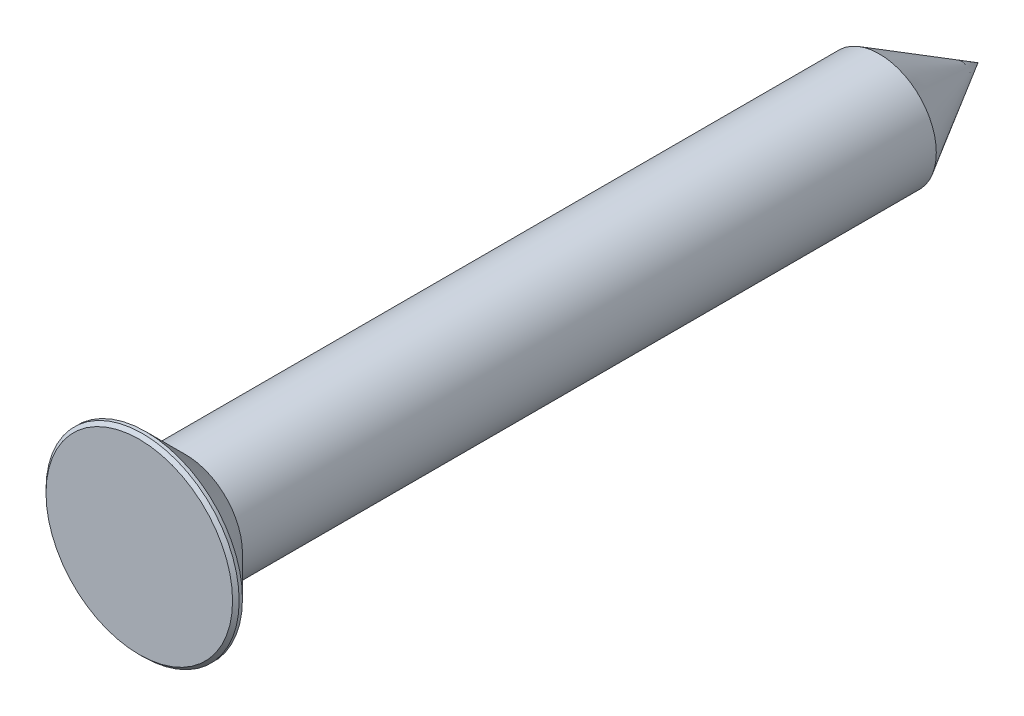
SolidWorks part; units mm, degrees
ref_plane "Спереди" through (0, 0, 0) normal (0, 0, 1) x (1, 0, 0)
ref_plane "Сверху" through (0, 0, 0) normal (0, 1, 0) x (1, 0, 0)
ref_plane "Справа" through (0, 0, 0) normal (1, 0, 0) x (0, 0, -1)
sketch "Эскиз1" plane through (0, 0, 0) normal (1, 0, 0) x (0, 0, -1)
  line L0 (0, 1.4125) -> (0, 0)
  line L1 (0, 0) -> (12.7, 0)
  line L2 (12.7, 0) -> (11.2061, 0.8625)
  line L3 (11.2061, 0.8625) -> (0.7, 0.8625)
  line L4 (0.7, 0.8625) -> (0.1, 1.4625)
  line L5 (0.1, 1.4625) -> (0.05, 1.4625)
  line L6 (0.05, 1.4625) -> (0, 1.4125)
  line L7 (0, 1.4625) -> (0, 1.5625) construction
  line L8 (0, 1.5625) -> (0.1, 1.4625) construction
  dimension "D1" = 0.8625
  dimension "D2" = 30
  dimension "D3" = 12.7
  dimension "D4" = 45
  dimension "D5" = 1.5625
  dimension "D6" = 0.1
  dimension "D9" = 0.05
revolve "Повернуть1" add sketch "Эскиз1" angle 360 about L1
